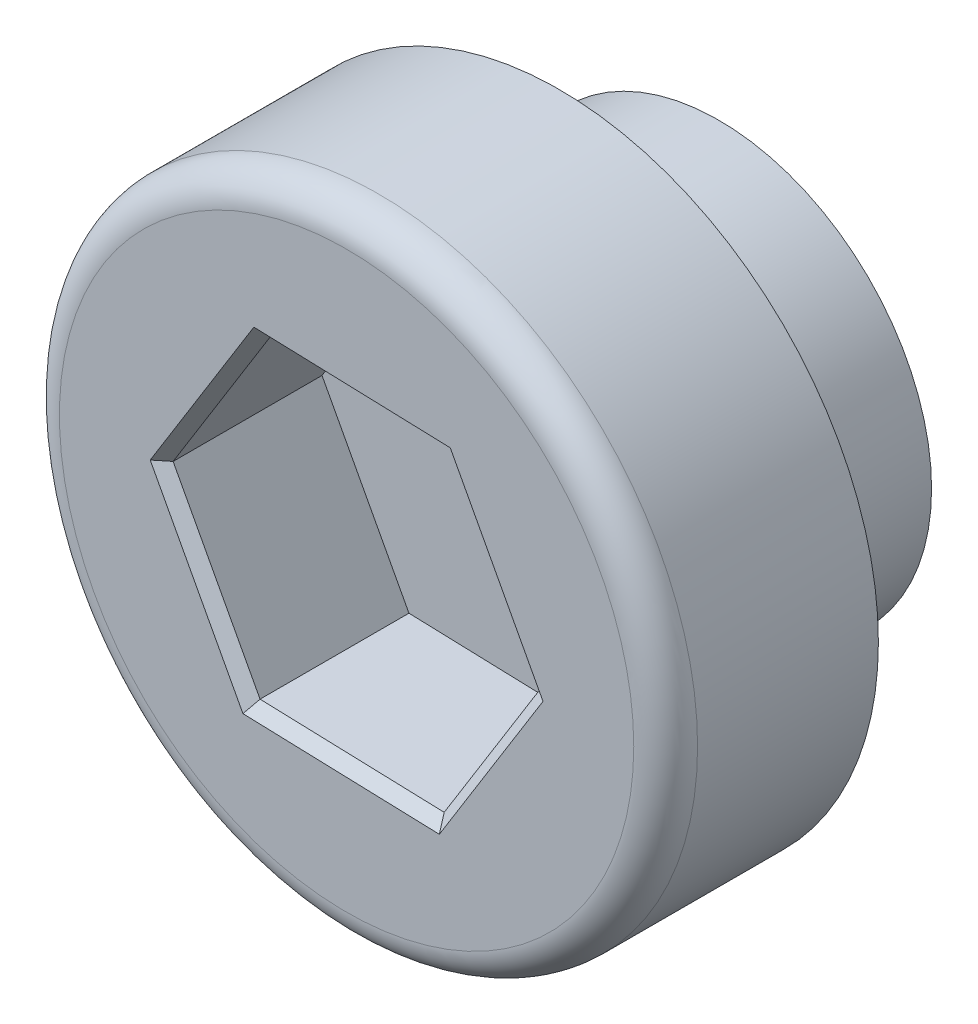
SolidWorks part; units mm, degrees
ref_plane "Płaszczyzna przednia" through (0, 0, 0) normal (0, 0, 1) x (1, 0, 0)
ref_plane "Płaszczyzna górna" through (0, 0, 0) normal (0, 1, 0) x (1, 0, 0)
ref_plane "Płaszczyzna prawa" through (0, 0, 0) normal (1, 0, 0) x (0, 0, -1)
sketch "Szkic1" plane through (0, 0, 0) normal (0, 0, 1) x (1, 0, 0)
  circle A0 centre (0, 0) radius 4
  dimension "D1" = 8
extrude "Dodanie-wyciągnięcie1" add sketch "Szkic1" along normal blind 3
sketch "Szkic2" plane through (0, 0, 3) normal (0, 0, 1) x (1, 0, 0)
  circle A0 centre (0, 0) radius 6
  dimension "D1" = 12
extrude "Dodanie-wyciągnięcie2" add sketch "Szkic2" along normal blind 4
sketch "Szkic3" plane through (0, 0, 7) normal (0, 0, 1) x (1, 0, 0)
  line L1 (-1.6349, 3.054) -> (-3.4623, 0.1112)
  line L2 (-3.4623, 0.1112) -> (-1.8274, -2.9429)
  line L3 (-1.8274, -2.9429) -> (1.6349, -3.054)
  line L4 (1.6349, -3.054) -> (3.4623, -0.1112)
  line L5 (3.4623, -0.1112) -> (1.8274, 2.9429)
  line L6 (1.8274, 2.9429) -> (-1.6349, 3.054)
  circle A0 centre (0, 0) radius 3 construction
  dimension "D1" = 6
extrude "Wytnij-wyciągnięcie1" cut sketch "Szkic3" against normal blind 3
fillet "Zaokrąglenie1" radius 0.6 1 edges at (6, 0, 7)
chamfer "Sfazowanie1" distance 0.2 angle 45 6 edges at (-0.0963, -2.9985, 7) (-2.6449, -1.4158, 7) (-2.5486, 1.5826, 7) (0.0963, 2.9985, 7) (2.6449, 1.4158, 7) (2.5486, -1.5826, 7)
